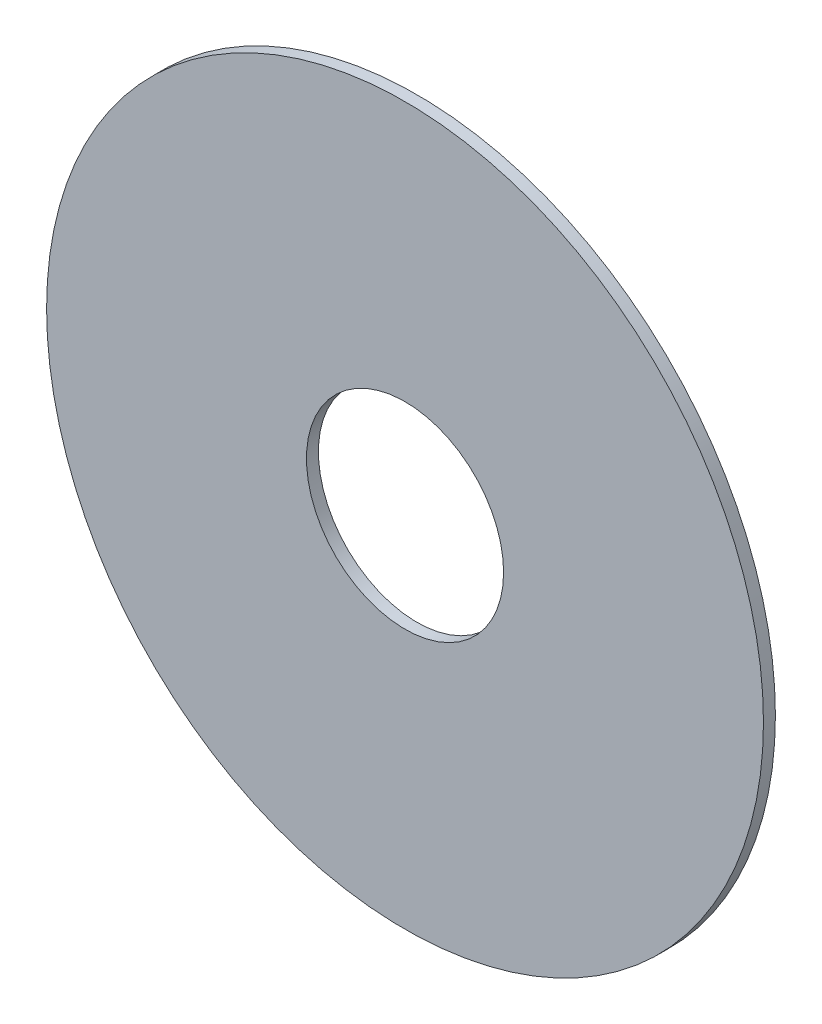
SolidWorks part; units mm, degrees
ref_plane "Face" through (0, 0, 0) normal (0, 0, 1) x (1, 0, 0)
ref_plane "Dessus" through (0, 0, 0) normal (0, 1, 0) x (1, 0, 0)
ref_plane "Droite" through (0, 0, 0) normal (1, 0, 0) x (0, 0, -1)
sketch "Esquisse1" plane through (0, 0, 0) normal (0, 0, 1) x (1, 0, 0)
  circle A0 centre (0, 0) radius 30
  circle A1 centre (0, 0) radius 8.25
  dimension "D1" = 16.5
  dimension "D2" = 60
extrude "Base-Extrusion" add sketch "Esquisse1" along normal blind 1
